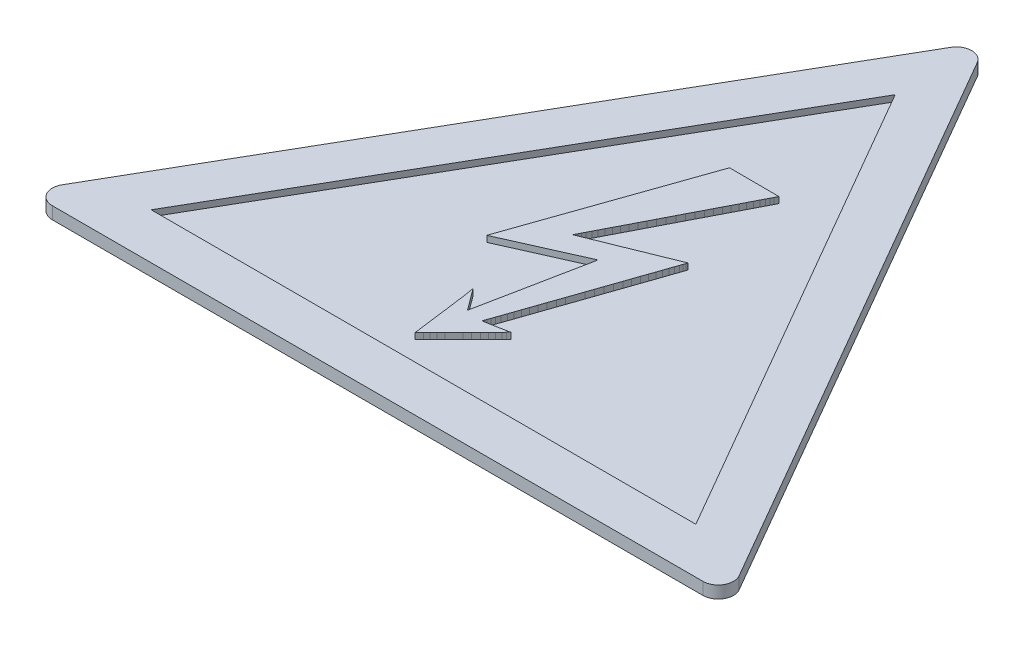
SolidWorks part; units mm, degrees
ref_plane "Vorne" through (0, 0, 0) normal (0, 0, 1) x (1, 0, 0)
ref_plane "Oben" through (0, 0, 0) normal (0, 1, 0) x (1, 0, 0)
ref_plane "Rechts" through (0, 0, 0) normal (1, 0, 0) x (0, 0, -1)
sketch "Skizze1" plane through (0, 0, 0) normal (0, 1, 0) x (1, 0, 0)
  line L0 (-15.8835, 2.5) -> (18.1545, 2.5) construction
  line L1 (0, -5.5346) -> (0, 10.5158) construction
  line L3 (-12.5, 15) -> (12.5, 15)
  line L4 (-12.5, 15) -> (-12.5, -10)
  line L5 (-12.5, -10) -> (12.5, -10)
  line L6 (12.5, 15) -> (12.5, -10)
  dimension "D1" = 25
  dimension "D2" = 25
  dimension "D3" = 2.5
extrude "Linear austragen1" add sketch "Skizze1" along normal blind 0.2
sketch "Skizze2" plane through (0, 0.2, 0) normal (0, 1, 0) x (-1, 0, 0)
  line L0 (11.5, 6.6395) -> (-5.75, -3.3198) construction
  line L1 (-11.5, 6.6395) -> (5.75, -3.3198) construction
  line L2 (0, -13.2791) -> (0, 6.6395) construction
  line L3 (11.5, 6.6395) -> (0, -13.2791)
  line L4 (0, -13.2791) -> (-11.5, 6.6395)
  line L5 (-11.5, 6.6395) -> (11.5, 6.6395)
  point P0 (0, 0)
  dimension "D1" = 23
extrude "Linear-Austragen-Dünn1" add sketch "Skizze2" along normal blind 0.2 thin
fillet "Verrundung1" radius 0.5 3 edges at (0, 0.3, -13.2791) (11.5, 0.3, 6.6395) (-11.5, 0.3, 6.6395)
sketch "Skizze3" plane through (-0.3778, 0.2, -0.6516) normal (0, 1, 0) x (1, 0, 0)
  line L0 (-0.2604, 4.8509) -> (-2.3171, -1.0288)
  line L1 (-2.3171, -1.0288) -> (0.1997, 0.0922)
  line L2 (0.1997, 0.0922) -> (0.1966, 0.0829)
  line L3 (0.1966, 0.0829) -> (0.1904, 0.052)
  line L4 (0.1904, 0.052) -> (0.1811, 0.0026)
  line L5 (0.1811, 0.0026) -> (0.1688, -0.0622)
  line L6 (0.1688, -0.0622) -> (0.1534, -0.1425)
  line L7 (0.1534, -0.1425) -> (0.1348, -0.2351)
  line L8 (0.1348, -0.2351) -> (0.1132, -0.3432)
  line L9 (0.1132, -0.3432) -> (0.0885, -0.4637)
  line L10 (0.0885, -0.4637) -> (0.0638, -0.5934)
  line L11 (0.0638, -0.5934) -> (0.036, -0.7354)
  line L12 (0.036, -0.7354) -> (0.0051, -0.8805)
  line L13 (0.0051, -0.8805) -> (-0.0258, -1.0349)
  line L14 (-0.0258, -1.0349) -> (-0.0566, -1.1924)
  line L15 (-0.0566, -1.1924) -> (-0.0906, -1.3561)
  line L16 (-0.0906, -1.3561) -> (-0.1215, -1.5229)
  line L17 (-0.1215, -1.5229) -> (-0.1555, -1.6896)
  line L18 (-0.1555, -1.6896) -> (-0.1894, -1.8564)
  line L19 (-0.1894, -1.8564) -> (-0.2203, -2.02)
  line L20 (-0.2203, -2.02) -> (-0.2543, -2.1837)
  line L21 (-0.2543, -2.1837) -> (-0.2852, -2.3412)
  line L22 (-0.2852, -2.3412) -> (-0.316, -2.4956)
  line L23 (-0.316, -2.4956) -> (-0.3469, -2.6438)
  line L24 (-0.3469, -2.6438) -> (-0.3747, -2.7828)
  line L25 (-0.3747, -2.7828) -> (-0.3994, -2.9125)
  line L26 (-0.3994, -2.9125) -> (-0.4241, -3.0329)
  line L27 (-0.4241, -3.0329) -> (-0.4457, -3.1379)
  line L28 (-0.4457, -3.1379) -> (-0.4643, -3.2336)
  line L29 (-0.4643, -3.2336) -> (-0.4797, -3.3139)
  line L30 (-0.4797, -3.3139) -> (-0.4921, -3.3788)
  line L31 (-0.4921, -3.3788) -> (-0.5013, -3.4251)
  line L32 (-0.5013, -3.4251) -> (-0.5075, -3.456)
  line L33 (-0.5075, -3.456) -> (-0.5106, -3.4652)
  line L34 (-0.5106, -3.4652) -> (-1.0386, -2.7519)
  line L35 (-1.0386, -2.7519) -> (-1.0355, -2.7612)
  line L36 (-1.0355, -2.7612) -> (-1.0294, -2.7828)
  line L37 (-1.0294, -2.7828) -> (-1.0232, -2.8167)
  line L38 (-1.0232, -2.8167) -> (-1.017, -2.86)
  line L39 (-1.017, -2.86) -> (-1.0078, -2.9125)
  line L40 (-1.0078, -2.9125) -> (-0.9985, -2.9712)
  line L41 (-0.9985, -2.9712) -> (-0.9892, -3.0391)
  line L42 (-0.9892, -3.0391) -> (-0.9769, -3.1163)
  line L43 (-0.9769, -3.1163) -> (-0.9645, -3.1966)
  line L44 (-0.9645, -3.1966) -> (-0.9553, -3.283)
  line L45 (-0.9553, -3.283) -> (-0.9429, -3.3757)
  line L46 (-0.9429, -3.3757) -> (-0.9275, -3.4714)
  line L47 (-0.9275, -3.4714) -> (-0.9151, -3.5671)
  line L48 (-0.9151, -3.5671) -> (-0.9028, -3.6691)
  line L49 (-0.9028, -3.6691) -> (-0.8873, -3.771)
  line L50 (-0.8873, -3.771) -> (-0.875, -3.8729)
  line L51 (-0.875, -3.8729) -> (-0.8626, -3.9748)
  line L52 (-0.8626, -3.9748) -> (-0.8503, -4.0767)
  line L53 (-0.8503, -4.0767) -> (-0.8348, -4.1755)
  line L54 (-0.8348, -4.1755) -> (-0.8225, -4.2743)
  line L55 (-0.8225, -4.2743) -> (-0.8101, -4.3669)
  line L56 (-0.8101, -4.3669) -> (-0.8009, -4.4565)
  line L57 (-0.8009, -4.4565) -> (-0.7885, -4.543)
  line L58 (-0.7885, -4.543) -> (-0.7792, -4.6202)
  line L59 (-0.7792, -4.6202) -> (-0.77, -4.6943)
  line L60 (-0.77, -4.6943) -> (-0.7607, -4.7591)
  line L61 (-0.7607, -4.7591) -> (-0.7514, -4.8178)
  line L62 (-0.7514, -4.8178) -> (-0.7453, -4.8641)
  line L63 (-0.7453, -4.8641) -> (-0.7422, -4.9043)
  line L64 (-0.7422, -4.9043) -> (-0.736, -4.9321)
  line L65 (-0.736, -4.9321) -> (-0.7329, -4.9506)
  line L66 (-0.7329, -4.9506) -> (-0.7329, -4.9568)
  line L67 (-0.7329, -4.9568) -> (-0.7175, -4.9413)
  line L68 (-0.7175, -4.9413) -> (-0.6681, -4.8919)
  line L69 (-0.6681, -4.8919) -> (-0.5909, -4.8147)
  line L70 (-0.5909, -4.8147) -> (-0.4921, -4.7128)
  line L71 (-0.4921, -4.7128) -> (-0.3747, -4.5955)
  line L72 (-0.3747, -4.5955) -> (-0.245, -4.4596)
  line L73 (-0.245, -4.4596) -> (-0.103, -4.3175)
  line L74 (-0.103, -4.3175) -> (0.0422, -4.1724)
  line L75 (0.0422, -4.1724) -> (0.1873, -4.0242)
  line L76 (0.1873, -4.0242) -> (0.3263, -3.8821)
  line L77 (0.3263, -3.8821) -> (0.4591, -3.7463)
  line L78 (0.4591, -3.7463) -> (0.5764, -3.6289)
  line L79 (0.5764, -3.6289) -> (0.6752, -3.527)
  line L80 (0.6752, -3.527) -> (0.7524, -3.4467)
  line L81 (0.7524, -3.4467) -> (0.8018, -3.3973)
  line L82 (0.8018, -3.3973) -> (0.8204, -3.3788)
  line L83 (0.8204, -3.3788) -> (0.8111, -3.3819)
  line L84 (0.8111, -3.3819) -> (0.7864, -3.3849)
  line L85 (0.7864, -3.3849) -> (0.7463, -3.3942)
  line L86 (0.7463, -3.3942) -> (0.6968, -3.4035)
  line L87 (0.6968, -3.4035) -> (0.6351, -3.4158)
  line L88 (0.6351, -3.4158) -> (0.5702, -3.4282)
  line L89 (0.5702, -3.4282) -> (0.4961, -3.4436)
  line L90 (0.4961, -3.4436) -> (0.4251, -3.456)
  line L91 (0.4251, -3.456) -> (0.351, -3.4714)
  line L92 (0.351, -3.4714) -> (0.2769, -3.4838)
  line L93 (0.2769, -3.4838) -> (0.212, -3.4961)
  line L94 (0.212, -3.4961) -> (0.1503, -3.5054)
  line L95 (0.1503, -3.5054) -> (0.1009, -3.5146)
  line L96 (0.1009, -3.5146) -> (0.0607, -3.5239)
  line L97 (0.0607, -3.5239) -> (0.036, -3.527)
  line L98 (0.036, -3.527) -> (0.0267, -3.527)
  line L99 (0.0267, -3.527) -> (0.0329, -3.5146)
  line L100 (0.0329, -3.5146) -> (0.0453, -3.4714)
  line L101 (0.0453, -3.4714) -> (0.07, -3.4035)
  line L102 (0.07, -3.4035) -> (0.1009, -3.3139)
  line L103 (0.1009, -3.3139) -> (0.141, -3.1997)
  line L104 (0.141, -3.1997) -> (0.1873, -3.0669)
  line L105 (0.1873, -3.0669) -> (0.2398, -2.9156)
  line L106 (0.2398, -2.9156) -> (0.2985, -2.7488)
  line L107 (0.2985, -2.7488) -> (0.3602, -2.5635)
  line L108 (0.3602, -2.5635) -> (0.4282, -2.369)
  line L109 (0.4282, -2.369) -> (0.4992, -2.1621)
  line L110 (0.4992, -2.1621) -> (0.5733, -1.9459)
  line L111 (0.5733, -1.9459) -> (0.6505, -1.7236)
  line L112 (0.6505, -1.7236) -> (0.7308, -1.4951)
  line L113 (0.7308, -1.4951) -> (0.8111, -1.2604)
  line L114 (0.8111, -1.2604) -> (0.8914, -1.0257)
  line L115 (0.8914, -1.0257) -> (0.9717, -0.7941)
  line L116 (0.9717, -0.7941) -> (1.052, -0.5594)
  line L117 (1.052, -0.5594) -> (1.1323, -0.3309)
  line L118 (1.1323, -0.3309) -> (1.2095, -0.1085)
  line L119 (1.2095, -0.1085) -> (1.2836, 0.1076)
  line L120 (1.2836, 0.1076) -> (1.3546, 0.3176)
  line L121 (1.3546, 0.3176) -> (1.4225, 0.5122)
  line L122 (1.4225, 0.5122) -> (1.4874, 0.6944)
  line L123 (1.4874, 0.6944) -> (1.543, 0.8642)
  line L124 (1.543, 0.8642) -> (1.5955, 1.0155)
  line L125 (1.5955, 1.0155) -> (1.6418, 1.1514)
  line L126 (1.6418, 1.1514) -> (1.6819, 1.2656)
  line L127 (1.6819, 1.2656) -> (1.7128, 1.3552)
  line L128 (1.7128, 1.3552) -> (1.7375, 1.4231)
  line L129 (1.7375, 1.4231) -> (1.7499, 1.4664)
  line L130 (1.7499, 1.4664) -> (1.756, 1.4818)
  line L131 (1.756, 1.4818) -> (1.7499, 1.4787)
  line L132 (1.7499, 1.4787) -> (1.7252, 1.4695)
  line L133 (1.7252, 1.4695) -> (1.6881, 1.454)
  line L134 (1.6881, 1.454) -> (1.6418, 1.4324)
  line L135 (1.6418, 1.4324) -> (1.58, 1.4077)
  line L136 (1.58, 1.4077) -> (1.509, 1.3799)
  line L137 (1.509, 1.3799) -> (1.4256, 1.3459)
  line L138 (1.4256, 1.3459) -> (1.3361, 1.3089)
  line L139 (1.3361, 1.3089) -> (1.2373, 1.2687)
  line L140 (1.2373, 1.2687) -> (1.1323, 1.2255)
  line L141 (1.1323, 1.2255) -> (1.0211, 1.1823)
  line L142 (1.0211, 1.1823) -> (0.9068, 1.1329)
  line L143 (0.9068, 1.1329) -> (0.7864, 1.0865)
  line L144 (0.7864, 1.0865) -> (0.6629, 1.0371)
  line L145 (0.6629, 1.0371) -> (0.5363, 0.9846)
  line L146 (0.5363, 0.9846) -> (0.4127, 0.9352)
  line L147 (0.4127, 0.9352) -> (0.2861, 0.8827)
  line L148 (0.2861, 0.8827) -> (0.1626, 0.8333)
  line L149 (0.1626, 0.8333) -> (0.0391, 0.7839)
  line L150 (0.0391, 0.7839) -> (-0.0813, 0.7345)
  line L151 (-0.0813, 0.7345) -> (-0.1956, 0.6882)
  line L152 (-0.1956, 0.6882) -> (-0.3068, 0.645)
  line L153 (-0.3068, 0.645) -> (-0.4118, 0.6017)
  line L154 (-0.4118, 0.6017) -> (-0.5106, 0.5616)
  line L155 (-0.5106, 0.5616) -> (-0.6001, 0.5276)
  line L156 (-0.6001, 0.5276) -> (-0.6835, 0.4936)
  line L157 (-0.6835, 0.4936) -> (-0.7545, 0.4658)
  line L158 (-0.7545, 0.4658) -> (-0.8132, 0.4411)
  line L159 (-0.8132, 0.4411) -> (-0.8626, 0.4195)
  line L160 (-0.8626, 0.4195) -> (-0.8997, 0.4072)
  line L161 (-0.8997, 0.4072) -> (-0.9213, 0.3979)
  line L162 (-0.9213, 0.3979) -> (-0.9275, 0.3948)
  line L163 (-0.9275, 0.3948) -> (-0.9213, 0.4072)
  line L164 (-0.9213, 0.4072) -> (-0.9028, 0.4442)
  line L165 (-0.9028, 0.4442) -> (-0.8719, 0.5029)
  line L166 (-0.8719, 0.5029) -> (-0.8317, 0.5863)
  line L167 (-0.8317, 0.5863) -> (-0.7792, 0.6851)
  line L168 (-0.7792, 0.6851) -> (-0.7175, 0.8055)
  line L169 (-0.7175, 0.8055) -> (-0.6495, 0.9383)
  line L170 (-0.6495, 0.9383) -> (-0.5723, 1.0896)
  line L171 (-0.5723, 1.0896) -> (-0.489, 1.2502)
  line L172 (-0.489, 1.2502) -> (-0.3994, 1.4262)
  line L173 (-0.3994, 1.4262) -> (-0.3037, 1.6084)
  line L174 (-0.3037, 1.6084) -> (-0.2049, 1.803)
  line L175 (-0.2049, 1.803) -> (-0.103, 2.0006)
  line L176 (-0.103, 2.0006) -> (0.002, 2.2044)
  line L177 (0.002, 2.2044) -> (0.107, 2.4113)
  line L178 (0.107, 2.4113) -> (0.2151, 2.6182)
  line L179 (0.2151, 2.6182) -> (0.3201, 2.8282)
  line L180 (0.3201, 2.8282) -> (0.4282, 3.0351)
  line L181 (0.4282, 3.0351) -> (0.5332, 3.2358)
  line L182 (0.5332, 3.2358) -> (0.6351, 3.4365)
  line L183 (0.6351, 3.4365) -> (0.7339, 3.628)
  line L184 (0.7339, 3.628) -> (0.8296, 3.8133)
  line L185 (0.8296, 3.8133) -> (0.9192, 3.9862)
  line L186 (0.9192, 3.9862) -> (1.0026, 4.1499)
  line L187 (1.0026, 4.1499) -> (1.0798, 4.2981)
  line L188 (1.0798, 4.2981) -> (1.1477, 4.434)
  line L189 (1.1477, 4.434) -> (1.2095, 4.5513)
  line L190 (1.2095, 4.5513) -> (1.262, 4.6532)
  line L191 (1.262, 4.6532) -> (1.3052, 4.7335)
  line L192 (1.3052, 4.7335) -> (1.3361, 4.7953)
  line L193 (1.3361, 4.7953) -> (1.3546, 4.8323)
  line L194 (1.3546, 4.8323) -> (1.3608, 4.8447)
  line L195 (1.3608, 4.8447) -> (-0.2604, 4.8509)
extrude "Linear austragen2" add sketch "Skizze3" along normal blind 0.2
sketch "Skizze4" plane through (0, 0.4, 0) normal (0, 1, 0) x (-1, 0, 0)
  line L3 (-11.067, 5.8895) -> (-0.433, -12.5291)
  line L4 (0.433, -12.5291) -> (11.067, 5.8895)
  line L5 (10.634, 6.6395) -> (-10.634, 6.6395)
  line L6 (-11.067, 5.8895) -> (-0.433, -12.5291)
  line L7 (0.433, -12.5291) -> (11.067, 5.8895)
  line L8 (10.634, 6.6395) -> (-10.634, 6.6395)
  arc A3 (-0.433, -12.5291) -> (0.433, -12.5291) centre (0, -12.2791) ccw
  arc A4 (11.067, 5.8895) -> (10.634, 6.6395) centre (10.634, 6.1395) ccw
  arc A5 (-10.634, 6.6395) -> (-11.067, 5.8895) centre (-10.634, 6.1395) ccw
  arc A6 (-0.433, -12.5291) -> (0.433, -12.5291) centre (0, -12.2791) ccw
  arc A7 (11.067, 5.8895) -> (10.634, 6.6395) centre (10.634, 6.1395) ccw
  arc A8 (-10.634, 6.6395) -> (-11.067, 5.8895) centre (-10.634, 6.1395) ccw
  dimension "D1" = 0
extrude "Schnitt-Linear austragen1" cut sketch "Skizze4" against normal up to next (0.4 mm away) flip side to cut
